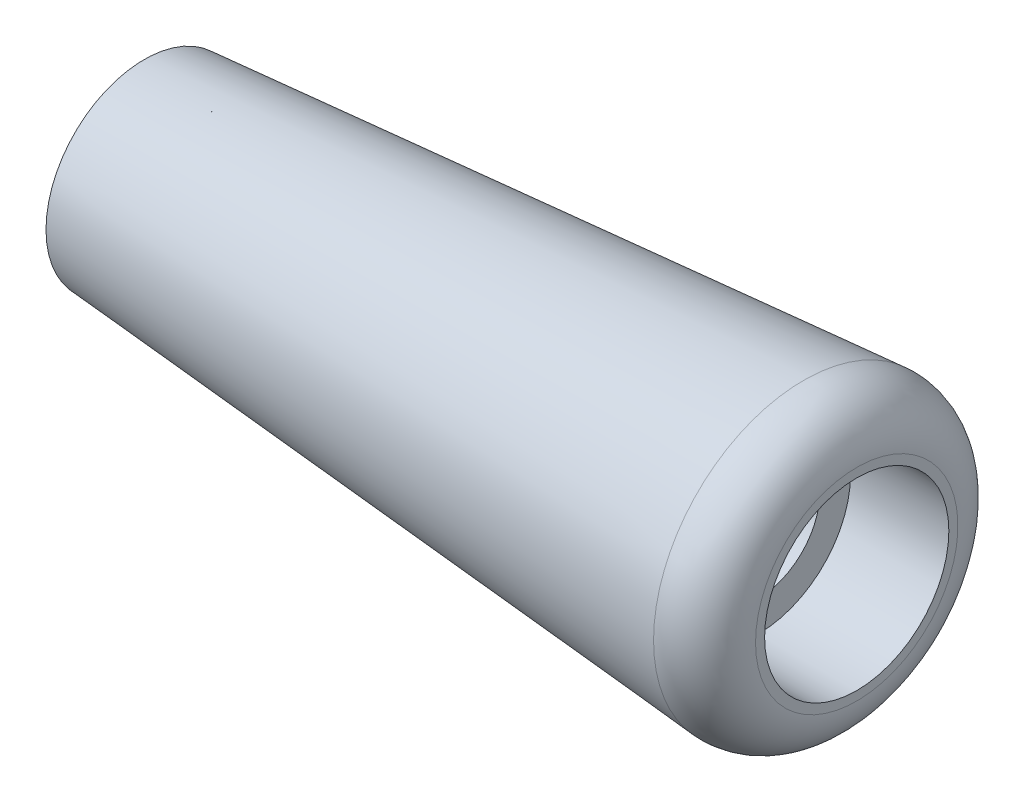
SolidWorks part; units mm, degrees
ref_plane "Plan de face" through (0, 0, 0) normal (0, 0, 1) x (1, 0, 0)
ref_plane "Plan de dessus" through (0, 0, 0) normal (0, 1, 0) x (1, 0, 0)
ref_plane "Plan de droite" through (0, 0, 0) normal (1, 0, 0) x (0, 0, -1)
sketch "Esquisse1" plane through (0, 0, 0) normal (0, 0, 1) x (1, 0, 0)
  line L0 (-59.8116, 0) -> (56.848, 0) construction
  line L1 (-44.4909, 5) -> (-44.4909, 8)
  line L2 (-44.4909, 8) -> (13.5091, 12.5647)
  line L3 (13.5091, 12.5647) -> (13.5091, 7.5)
  line L4 (13.5091, 7.5) -> (5.5091, 7.5)
  line L5 (5.5091, 7.5) -> (5.5091, 5)
  line L6 (5.5091, 5) -> (-44.4909, 5)
  dimension "D1" = 10
  dimension "D2" = 15
  dimension "D3" = 8
  dimension "D4" = 58
  dimension "D5" = 4.5
  dimension "D6" = 8
revolve "Révolution2" add sketch "Esquisse1" angle 360 about L0
fillet "Congé1" radius 4 1 edges at (13.5091, 0, 12.5647)
chamfer "Chanfrein1" distance 0.5 angle 45 1 edges at (-44.4909, 0, 5)
